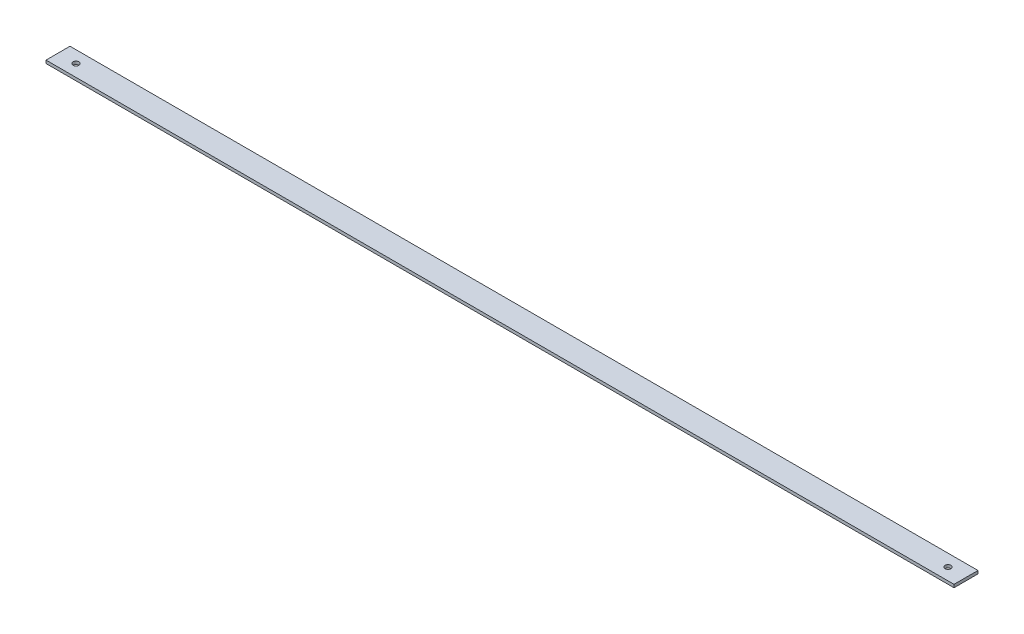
SolidWorks part; units mm, degrees
ref_plane "Front Plane" through (0, 0, 0) normal (0, 0, 1) x (1, 0, 0)
ref_plane "Top Plane" through (0, 0, 0) normal (0, 1, 0) x (1, 0, 0)
ref_plane "Right Plane" through (0, 0, 0) normal (1, 0, 0) x (0, 0, -1)
sketch "Sketch1" plane through (0, 0, 0) normal (0, 1, 0) x (1, 0, 0)
  line L1 (-480.695, 12.7) -> (480.695, 12.7)
  line L2 (-480.695, 12.7) -> (-480.695, -12.7)
  line L3 (-480.695, -12.7) -> (480.695, -12.7)
  line L4 (480.695, 12.7) -> (480.695, -12.7)
  line L5 (-480.695, 12.7) -> (480.695, -12.7) construction
  line L6 (-480.695, -12.7) -> (480.695, 12.7) construction
  point P0 (0, 0)
  dimension "D1" = 961.39
  dimension "D2" = 25.4
extrude "Boss-Extrude1" add sketch "Sketch1" along normal blind 3.175
sketch "Sketch2" plane through (0, 3.175, 0) normal (0, 1, 0) x (1, 0, 0)
  line L0 (-480.695, 12.7) -> (-480.695, -12.7) construction
  line L1 (480.695, -12.7) -> (480.695, 12.7) construction
  line L2 (-480.695, -12.7) -> (480.695, -12.7) construction
  circle A0 centre (461.645, 0) radius 3.175
  circle A1 centre (-461.645, 0) radius 3.175
  dimension "D1" = 6.35
  dimension "D2" = 6.35
  dimension "D3" = 19.05
  dimension "D4" = 19.05
  dimension "D5" = 12.7
  dimension "D6" = 12.7
extrude "Cut-Extrude1" cut sketch "Sketch2" against normal through all
